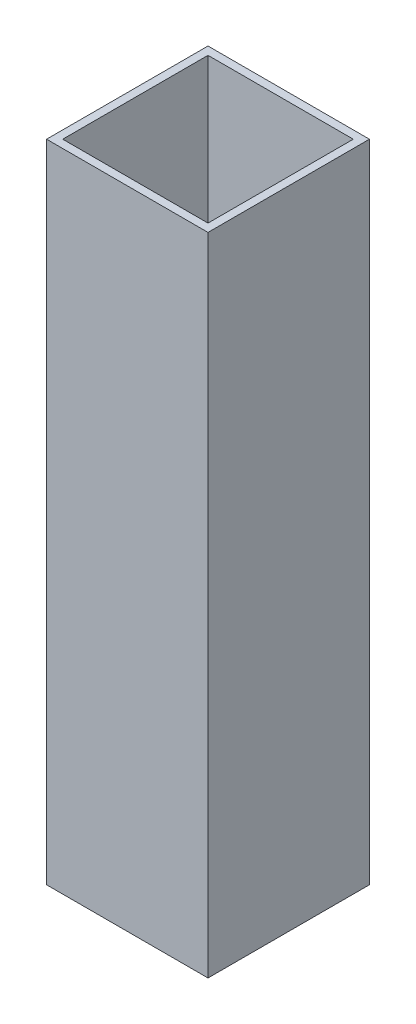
SolidWorks part; units mm, degrees
ref_plane "Front Plane" through (0, 0, 0) normal (0, 0, 1) x (1, 0, 0)
ref_plane "Top Plane" through (0, 0, 0) normal (0, 1, 0) x (1, 0, 0)
ref_plane "Right Plane" through (0, 0, 0) normal (1, 0, 0) x (0, 0, -1)
sketch "Sketch1" plane through (0, 0, 0) normal (0, 1, 0) x (1, 0, 0)
  line L1 (-25, 25) -> (25, 25)
  line L2 (-25, 25) -> (-25, -25)
  line L3 (-25, -25) -> (25, -25)
  line L4 (25, 25) -> (25, -25)
  line L5 (-25, 25) -> (25, -25) construction
  line L6 (-25, -25) -> (25, 25) construction
  point P0 (0, 0)
  dimension "D1" = 50
extrude "Boss-Extrude1" add sketch "Sketch1" along normal blind 200
shell "Shell1" thickness 2.5
